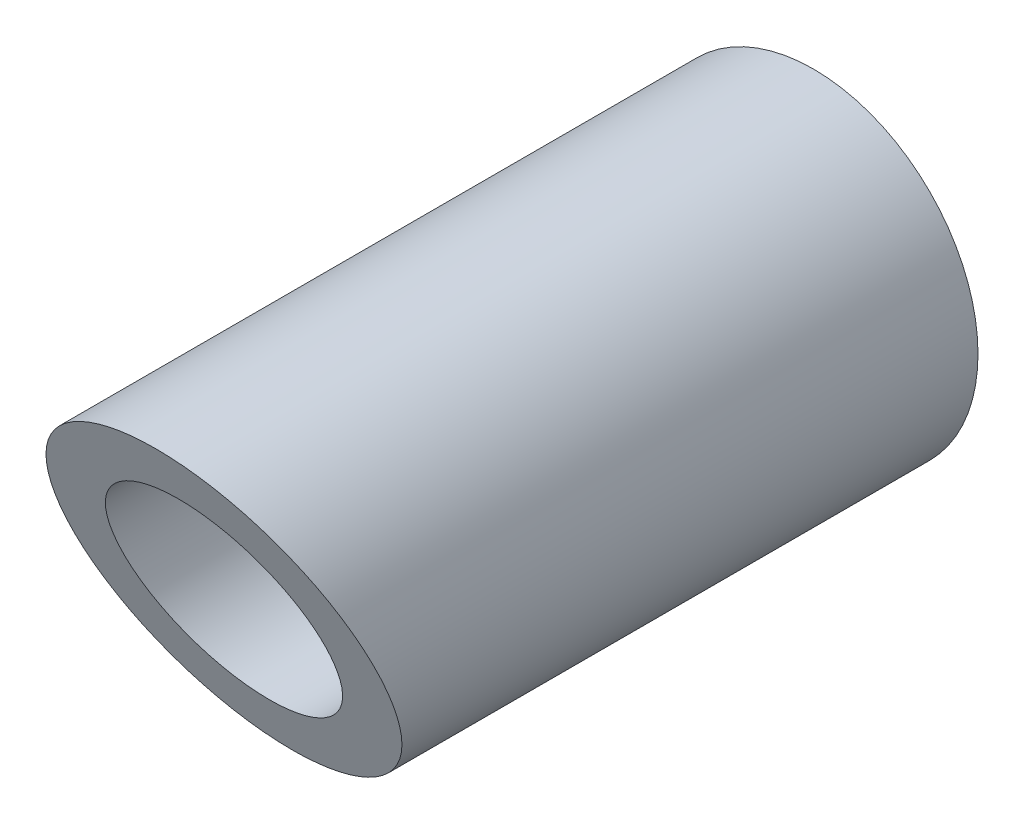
SolidWorks part; units mm, degrees
ref_plane "Vorne" through (0, 0, 0) normal (0, 0, 1) x (1, 0, 0)
ref_plane "Oben" through (0, 0, 0) normal (0, 1, 0) x (1, 0, 0)
ref_plane "Rechts" through (0, 0, 0) normal (1, 0, 0) x (0, 0, -1)
sketch "Skizze1" plane through (0, 0, 0) normal (0, 0, 1) x (1, 0, 0)
  circle A0 centre (0, 0) radius 5
  circle A1 centre (0, 0) radius 7.5
  dimension "D1" = 10
  dimension "D2" = 15
extrude "Linear austragen1" add sketch "Skizze1" along normal blind 30
sketch "Skizze2" plane through (0, 0, 0) normal (1, 0, 0) x (0, 0, -1)
  line L0 (-30, 7.5) -> (-23.7868, -7.5)
  line L1 (-30, -7.5) -> (0, -7.5) construction
  line L2 (-30, 7.5) -> (-30, -7.5) construction
  dimension "D1" = 22.5
extrude "Schnitt-Linear austragen1" cut sketch "Skizze2" against normal through all and the other way through all flip side to cut
sketch "Skizze3" plane through (0, 0, 0) normal (1, 0, 0) x (0, 0, -1)
  line L0 (-26.9877, 5) -> (-29.5858, 6.5)
  line L1 (-30, 7.5) -> (-23.7868, -7.5) construction
  line L2 (-26.9877, 5) -> (-32.6805, 5) construction
  dimension "D1" = 30
  dimension "D2" = 6.5
  dimension "D3" = 5
